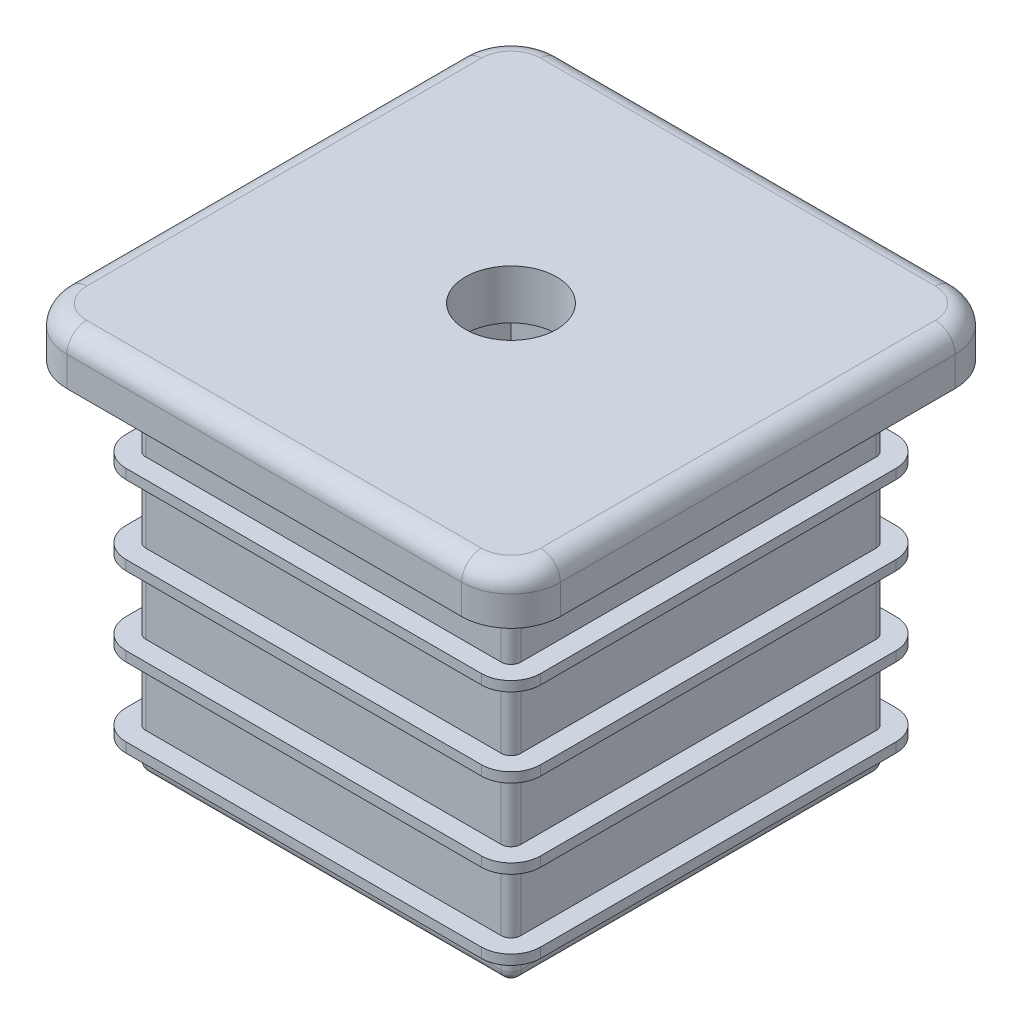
SolidWorks part; units mm, degrees
ref_plane "Plan de face" through (0, 0, 0) normal (0, 0, 1) x (1, 0, 0)
ref_plane "Plan de dessus" through (0, 0, 0) normal (0, 1, 0) x (1, 0, 0)
ref_plane "Plan de droite" through (0, 0, 0) normal (1, 0, 0) x (0, 0, -1)
sketch "Esquisse1" plane through (0, 0, 0) normal (0, 1, 0) x (1, 0, 0)
  line L1 (-10, 12.5) -> (10, 12.5)
  line L2 (-12.5, 10) -> (-12.5, -10)
  line L3 (-10, -12.5) -> (10, -12.5)
  line L4 (12.5, 10) -> (12.5, -10)
  line L5 (-12.5, 12.5) -> (12.5, -12.5) construction
  line L6 (-12.5, -12.5) -> (12.5, 12.5) construction
  arc A0 (-12.5, -10) -> (-10, -12.5) centre (-10, -10) ccw
  arc A1 (10, -12.5) -> (12.5, -10) centre (10, -10) ccw
  arc A2 (10, 12.5) -> (12.5, 10) centre (10, 10) cw
  arc A3 (-10, 12.5) -> (-12.5, 10) centre (-10, 10) ccw
  point P0 (0, 0)
  dimension "D2" = 2.5
  dimension "D1" = 25
extrude "Boss.-Extru.1" add sketch "Esquisse1" along normal blind 2.5
fillet "Congé1" radius 1 8 edges at (-11.7678, 2.5, 11.7678) (-12.5, 2.5, 0) (-11.7678, 2.5, -11.7678) (0, 2.5, -12.5) (11.7678, 2.5, -11.7678) (12.5, 2.5, 0) (11.7678, 2.5, 11.7678) (0, 2.5, 12.5)
sketch "Esquisse2" plane through (0, 0, 0) normal (0, -1, 0) x (1, 0, 0)
  line L1 (-9.5, 9.5) -> (9.5, 9.5)
  line L2 (-9.5, 9.5) -> (-9.5, -9.5)
  line L3 (-9.5, -9.5) -> (9.5, -9.5)
  line L4 (9.5, 9.5) -> (9.5, -9.5)
  line L5 (-9.5, 9.5) -> (9.5, -9.5) construction
  line L6 (-9.5, -9.5) -> (9.5, 9.5) construction
  point P0 (0, 0)
  dimension "D1" = 19
extrude "Extru.-Mince1" add sketch "Esquisse2" along normal blind 18 thin
fillet "Congé2" radius 0.5 4 edges at (-9.5, -9, 9.5) (-9.5, -9, -9.5) (9.5, -9, 9.5) (9.5, -9, -9.5)
fillet "Congé3" radius 0.5 8 edges at (-9.3536, -18, 9.3536) (0, -18, 9.5) (9.3536, -18, 9.3536) (9.5, -18, 0) (9.3536, -18, -9.3536) (0, -18, -9.5) (-9.3536, -18, -9.3536) (-9.5, -18, 0)
ref_plane "Plan1" through (0, -4, 0) normal (0, -1, 0) x (-1, 0, 0)
sketch "Esquisse3" plane through (0, -4, 0) normal (0, -1, 0) x (-1, 0, 0)
  line L0 (9.5, -9) -> (9.5, 9) construction
  line L1 (-9, -9.5) -> (9, -9.5) construction
  line L2 (-9.5, 9) -> (-9.5, -9) construction
  line L3 (9, 9.5) -> (-9, 9.5) construction
  line L4 (9.5, -9) -> (9.5, 9)
  line L5 (-9, -9.5) -> (9, -9.5)
  line L6 (-9.5, 9) -> (-9.5, -9)
  line L7 (9, 9.5) -> (-9, 9.5)
  line L8 (10.5, -9) -> (10.5, 9)
  line L9 (9, 10.5) -> (-9, 10.5)
  line L10 (-10.5, 9) -> (-10.5, -9)
  line L11 (-9, -10.5) -> (9, -10.5)
  arc A0 (9, -9.5) -> (9.5, -9) centre (9, -9) ccw construction
  arc A1 (-9.5, -9) -> (-9, -9.5) centre (-9, -9) ccw construction
  arc A2 (-9, 9.5) -> (-9.5, 9) centre (-9, 9) ccw construction
  arc A3 (9.5, 9) -> (9, 9.5) centre (9, 9) ccw construction
  arc A4 (9, -9.5) -> (9.5, -9) centre (9, -9) ccw
  arc A5 (-9.5, -9) -> (-9, -9.5) centre (-9, -9) ccw
  arc A6 (-9, 9.5) -> (-9.5, 9) centre (-9, 9) ccw
  arc A7 (9.5, 9) -> (9, 9.5) centre (9, 9) ccw
  arc A8 (10.5, 9) -> (9, 10.5) centre (9, 9) ccw
  arc A9 (-9, 10.5) -> (-10.5, 9) centre (-9, 9) ccw
  arc A10 (-10.5, -9) -> (-9, -10.5) centre (-9, -9) ccw
  arc A11 (9, -10.5) -> (10.5, -9) centre (9, -9) ccw
  dimension "D1" = 1
extrude "Boss.-Extru.2" add sketch "Esquisse3" along normal blind 0.5
pattern_linear "Répétition linéaire1" count 4 spacing 4 along (0, -1, 0) of "Boss.-Extru.2"
sketch "Esquisse4" plane through (0, 2.5, 0) normal (0, 1, 0) x (1, 0, 0)
  circle A0 centre (0, 0) radius 2.31
  dimension "D1" = 4.62
extrude "Enlèv. mat.-Extru.1" cut sketch "Esquisse4" against normal through all
